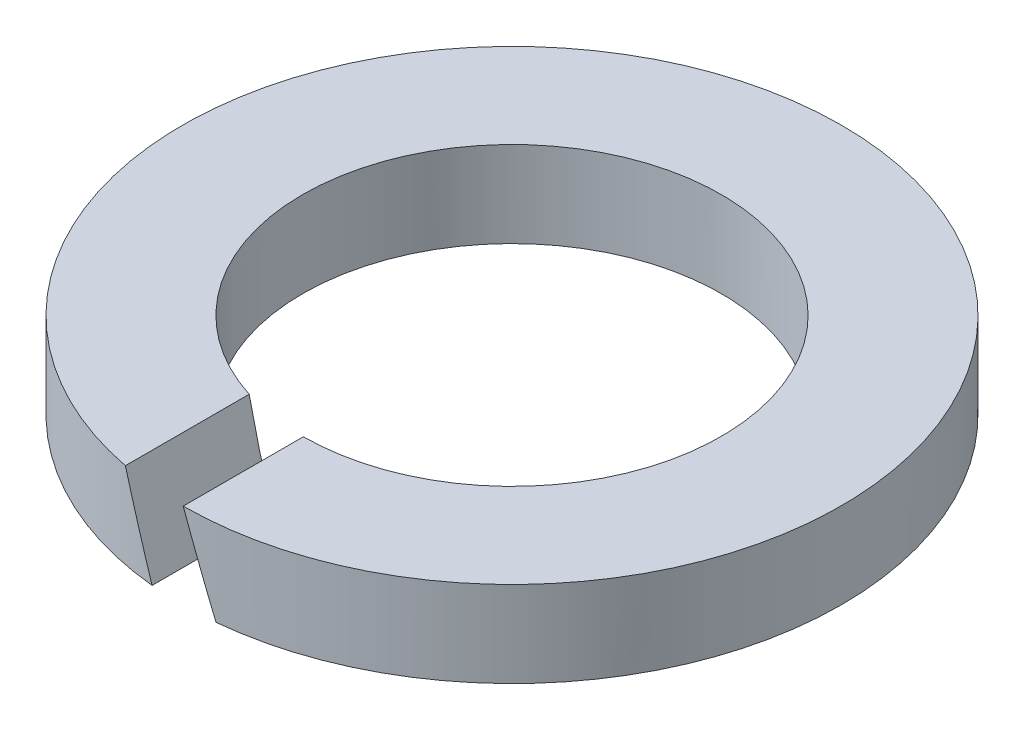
SolidWorks part; units mm, degrees
ref_plane "Спереди" through (0, 0, 0) normal (0, 0, 1) x (1, 0, 0)
ref_plane "Сверху" through (0, 0, 0) normal (0, 1, 0) x (1, 0, 0)
ref_plane "Справа" through (0, 0, 0) normal (1, 0, 0) x (0, 0, -1)
sketch "Ske" plane through (0, 0, 0) normal (0, 0, 1) x (1, 0, 0)
  line L0 (0, 15.7597) -> (0, -13.7032) construction
  line L1 (-6.1, 0) -> (-9.6, 0)
  line L2 (-6.1, 0) -> (-6.1, 2.5)
  line L3 (-6.1, 2.5) -> (-9.6, 2.5)
  line L4 (-9.6, 0) -> (-9.6, 2.5)
revolve "Base" add sketch "Ske" angle 360 about L0
sketch "Ske4" plane through (0, 0, 0) normal (0, 0, 1) x (1, 0, 0)
  line L0 (0, 0) -> (-0.6869, 1.8873) construction
  line L1 (-6.1, 0) -> (6.1, 0) construction
  line L2 (6.1, 2.5) -> (-6.1, 2.5) construction
  line L3 (-0.9312, 0) -> (0.9312, 0)
  line L4 (0.0212, 2.5) -> (-1.8411, 2.5)
  line L5 (0.0212, 2.5) -> (0.9312, 0)
  line L6 (-1.8411, 2.5) -> (-0.9312, 0)
extrude "Cut" cut sketch "Ske4" along normal up to next
equation "\"D2@Ske4\"=0.7*\"H@Ske\""
